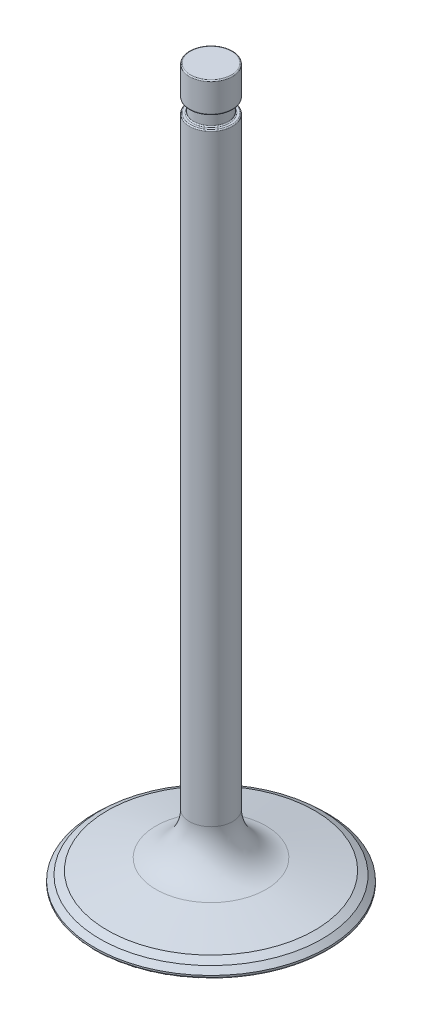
SolidWorks part; units mm, degrees
ref_plane "Front Plane" through (0, 0, 0) normal (0, 0, 1) x (1, 0, 0)
ref_plane "Top Plane" through (0, 0, 0) normal (0, 1, 0) x (1, 0, 0)
ref_plane "Right Plane" through (0, 0, 0) normal (1, 0, 0) x (0, 0, -1)
sketch "Sketch1" plane through (0, 0, 0) normal (0, 0, 1) x (1, 0, 0)
  line L0 (0, 0) -> (0, 165)
  line L1 (0, 0) -> (-27, 0)
  line L2 (-27, 0) -> (-27, 2)
  line L3 (-27, 2) -> (-5, 7)
  line L4 (-5, 7) -> (-5, 155)
  line L5 (-5, 165) -> (0, 165)
  line L6 (-5, 158) -> (-4, 158)
  line L7 (-4, 158) -> (-4, 155)
  line L8 (-4, 155) -> (-5, 155)
  line L9 (-5, 158) -> (-5, 165)
  dimension "D1" = 165
  dimension "D2" = 5
  dimension "D3" = 27
  dimension "D4" = 2
  dimension "D5" = 7
  dimension "D6" = 3
  dimension "D7" = 1
  dimension "D8" = 7
revolve "Revolve1" add sketch "Sketch1" angle 360 about L0
fillet "Fillet1" radius 10 1 edges at (0, 7, -5)
chamfer "Chamfer1" distance 2 angle 30 1 edges at (0, 2, -27)
chamfer "Chamfer3" distance 1 angle 15 1 edges at (0, 2.4432, 25.0497)
fillet "Fillet2" radius 0.25 6 edges at (0, 158, -4) (0, 155, -4) (0, 165, -5) (0, 158, -5) (0, 0, -27) (0, 155, -5)
